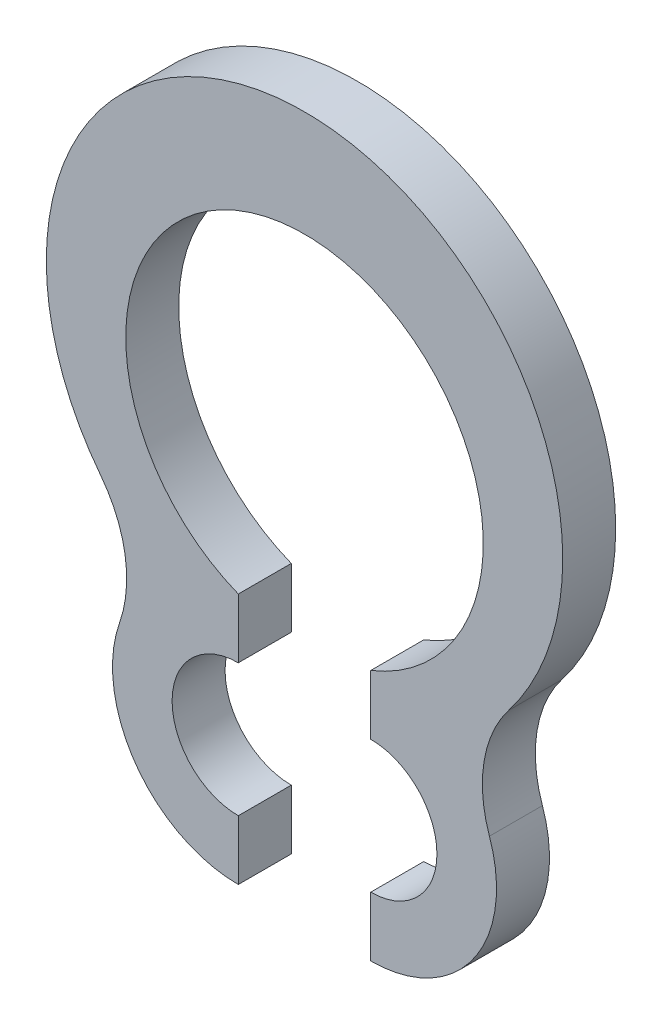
SolidWorks part; units mm, degrees
ref_plane "Front" through (0, 0, 0) normal (0, 0, 1) x (1, 0, 0)
ref_plane "Top" through (0, 0, 0) normal (0, 1, 0) x (1, 0, 0)
ref_plane "Right" through (0, 0, 0) normal (1, 0, 0) x (0, 0, -1)
sketch "Sketch1" plane through (0, 0, 0) normal (0, 0, 1) x (1, 0, 0)
  line L0 (0, -0.2) -> (0, -3.1859) construction
  line L1 (-0.5, -1.454) -> (-0.5, -1.904)
  line L2 (-0.5, -2.904) -> (-0.5, -3.354)
  line L3 (0.5, -2.904) -> (0.5, -3.354)
  line L4 (0.5, -1.454) -> (0.5, -1.904)
  arc A0 (0.5, -1.454) -> (-0.5, -1.454) centre (0, -0.2) ccw
  arc A1 (1.5419, -1.1938) -> (-1.5419, -1.1938) centre (0, 0) ccw
  arc A2 (-0.5, -1.904) -> (-0.5, -2.904) centre (-0.5, -2.404) ccw
  arc A3 (-0.5, -3.354) -> (-1.3965, -2.0897) centre (-0.5, -2.404) cw
  arc A4 (-1.5419, -1.1938) -> (-1.3965, -2.0897) centre (-2.293, -1.7754) cw
  arc A5 (1.5419, -1.1938) -> (1.3965, -2.0897) centre (2.293, -1.7754) ccw
  arc A6 (0.5, -3.354) -> (1.3965, -2.0897) centre (0.5, -2.404) ccw
  arc A7 (0.5, -1.904) -> (0.5, -2.904) centre (0.5, -2.404) cw
  dimension "d" = 2.7
  dimension "D0" = 3.9
  dimension "R3" = 0.95
  dimension "c" = 0.2
  dimension "B1" = 1
  dimension "d1" = 1
  dimension "D2" = 1
  dimension "h" = 0.95
extrude "Body" add sketch "Sketch1" against normal blind 0.4 separate body
equation "\"D2@Sketch1\" = \"d1@Sketch1\""
equation "\"R3@Sketch1\" = \"h@Sketch1\""
